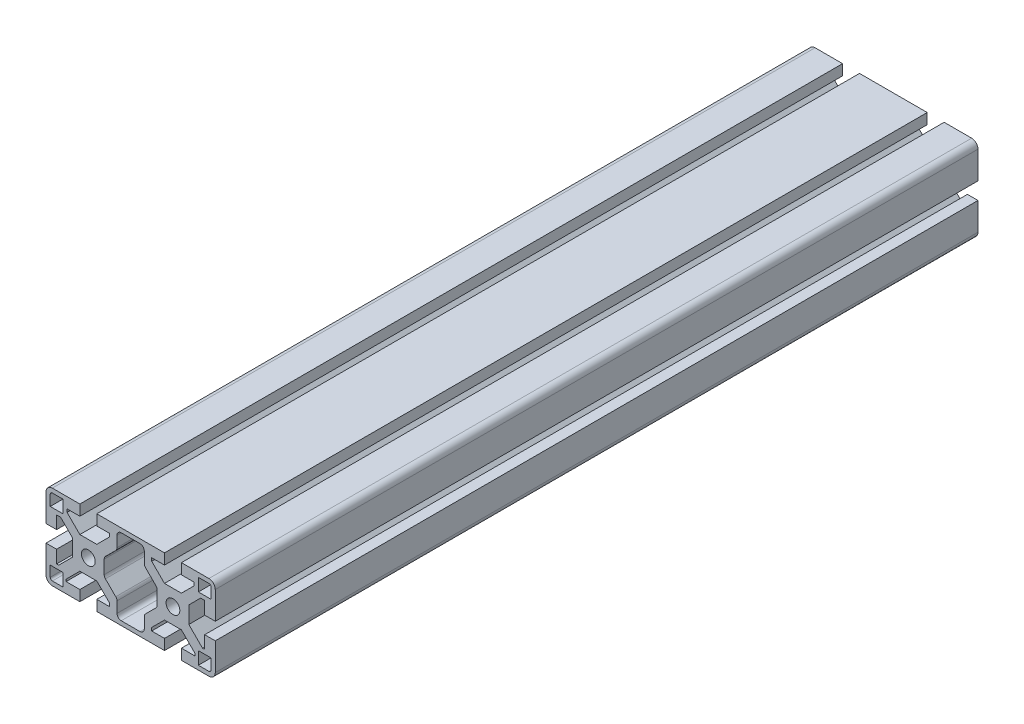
SolidWorks part; units mm, degrees
ref_plane "Alzado" through (0, 0, 0) normal (0, 0, 1) x (1, 0, 0)
ref_plane "Planta" through (0, 0, 0) normal (0, 1, 0) x (1, 0, 0)
ref_plane "Vista lateral" through (0, 0, 0) normal (1, 0, 0) x (0, 0, -1)
sketch "Croquis1" plane through (0, 0, 0) normal (0, 0, 1) x (1, 0, 0)
  line L0 (-18, 12) -> (-12, 12)
  line L1 (-12, 12) -> (-12, 18)
  line L2 (-17, 18) -> (-12, 18)
  line L3 (-18, 12) -> (-18, 17)
  line L4 (24.45, 18) -> (15.55, 18)
  line L5 (31.9142, 4.5858) -> (27.0358, 9.4642)
  line L6 (31.9142, -4.5858) -> (27.0358, -9.4642)
  line L7 (50.0629, 13.55) -> (50.0629, 15)
  line L8 (-17, -18) -> (-12, -18)
  line L9 (-12, -18) -> (-12, -12)
  line L10 (-18, -12) -> (-12, -12)
  line L11 (-18, -17) -> (-18, -12)
  line L12 (50.0629, 13.55) -> (44, 7.5)
  line L13 (50.0629, 15) -> (44, 15)
  line L14 (29.95, 13.55) -> (29.95, 15)
  line L15 (36, 7.5) -> (29.95, 13.55)
  line L16 (-4, 7.5) -> (4, 7.5)
  line L17 (-17, 20) -> (-4, 20)
  line L18 (-7.5, -3.55) -> (-7.5, 4.45)
  line L19 (-4, -7.5) -> (4, -7.5)
  line L20 (7.5, -3.1716) -> (7.5, 3.1716)
  line L21 (36, 15) -> (29.95, 15)
  line L22 (4, 20) -> (4, 15)
  line L23 (55, 10.05) -> (53.1, 10.05)
  line L24 (4, 20) -> (36, 20)
  line L25 (-17, -20) -> (-4, -20)
  line L26 (-4, -20) -> (-4, -15)
  line L27 (36, -20) -> (4, -20)
  line L28 (-15, -10.05) -> (-15, -4)
  line L29 (-20, 4) -> (-20, 17)
  line L30 (-20, -17) -> (-20, -4)
  line L31 (-20, -4) -> (-15, -4)
  line L32 (4, -20) -> (4, -15)
  line L33 (-4, 20) -> (-4, 15)
  line L34 (47.5, 4.45) -> (53.1, 10.05)
  line L35 (55, 4) -> (55, 10.05)
  line L36 (60, 4) -> (55, 4)
  line L37 (4, -15) -> (10.05, -15)
  line L38 (-10.5, -15) -> (-4, -15)
  line L39 (-10.5, -14) -> (-4, -7.5)
  line L40 (-10.5, -14) -> (-10.5, -15)
  line L41 (4, -7.5) -> (10.05, -13.55)
  line L42 (10.05, -15) -> (10.05, -13.55)
  line L43 (-7.5, -3.55) -> (-14, -10.05)
  line L44 (-15, -10.05) -> (-14, -10.05)
  line L45 (-20, 4) -> (-15, 4)
  line L46 (-15, 4) -> (-15, 10.05)
  line L47 (-7.5, 4.45) -> (-13.1, 10.05)
  line L48 (-15, 10.05) -> (-13.1, 10.05)
  line L49 (4, 15) -> (10.05, 15)
  line L50 (4, 7.5) -> (10.05, 13.55)
  line L51 (10.05, 13.55) -> (10.05, 15)
  line L52 (-10.0629, 15) -> (-4, 15)
  line L53 (-10.0629, 13.55) -> (-4, 7.5)
  line L54 (-10.0629, 13.55) -> (-10.0629, 15)
  line L55 (55, -10.05) -> (54, -10.05)
  line L56 (47.5, -3.55) -> (54, -10.05)
  line L57 (8.0858, -4.5858) -> (12.9642, -9.4642)
  line L58 (29.95, -15) -> (29.95, -13.55)
  line L59 (8.0858, 4.5858) -> (12.9642, 9.4642)
  line L60 (36, -7.5) -> (29.95, -13.55)
  line L61 (50.5, -14) -> (50.5, -15)
  line L62 (50.5, -14) -> (44, -7.5)
  line L63 (50.5, -15) -> (44, -15)
  line L64 (36, -15) -> (29.95, -15)
  line L65 (44, 20) -> (44, 15)
  line L66 (36, -20) -> (36, -15)
  line L67 (60, -4) -> (55, -4)
  line L68 (60, -17) -> (60, -4)
  line L69 (60, 4) -> (60, 17)
  line L70 (55, -10.05) -> (55, -4)
  line L71 (44, -20) -> (44, -15)
  line L72 (57, -20) -> (44, -20)
  line L73 (36, 20) -> (36, 15)
  line L74 (32.5, -3.1716) -> (32.5, 3.1716)
  line L75 (44, -7.5) -> (36, -7.5)
  line L76 (47.5, -3.55) -> (47.5, 4.45)
  line L77 (57, 20) -> (44, 20)
  line L78 (44, 7.5) -> (36, 7.5)
  line L79 (58, -17) -> (58, -12)
  line L80 (58, -12) -> (52, -12)
  line L81 (52, -18) -> (52, -12)
  line L82 (57, -18) -> (52, -18)
  line L83 (58, 12) -> (58, 17)
  line L84 (57, 18) -> (52, 18)
  line L85 (52, 12) -> (52, 18)
  line L86 (58, 12) -> (52, 12)
  line L87 (13.55, 10.8784) -> (13.55, 16)
  line L88 (26.45, 10.8784) -> (26.45, 16)
  line L89 (24.45, -18) -> (15.55, -18)
  line L90 (13.55, -10.8784) -> (13.55, -16)
  line L91 (26.45, -10.8784) -> (26.45, -16)
  arc A0 (-18, 17) -> (-17, 18) centre (-17, 17) cw
  arc A1 (57, -20) -> (60, -17) centre (57, -17) ccw
  arc A2 (-18, -17) -> (-17, -18) centre (-17, -17) ccw
  arc A3 (60, 17) -> (57, 20) centre (57, 17) ccw
  circle A4 centre (0, 0) radius 3.25
  circle A5 centre (40, 0) radius 3.25
  arc A6 (-20, 17) -> (-17, 20) centre (-17, 17) cw
  arc A7 (-17, -20) -> (-20, -17) centre (-17, -17) cw
  arc A8 (58, -17) -> (57, -18) centre (57, -17) cw
  arc A9 (58, 17) -> (57, 18) centre (57, 17) ccw
  arc A10 (13.55, 16) -> (15.55, 18) centre (15.55, 16) cw
  arc A11 (12.9642, 9.4642) -> (13.55, 10.8784) centre (11.55, 10.8784) ccw
  arc A12 (7.5, 3.1716) -> (8.0858, 4.5858) centre (9.5, 3.1716) cw
  arc A13 (8.0858, -4.5858) -> (7.5, -3.1716) centre (9.5, -3.1716) cw
  arc A14 (13.55, -10.8784) -> (12.9642, -9.4642) centre (11.55, -10.8784) ccw
  arc A15 (15.55, -18) -> (13.55, -16) centre (15.55, -16) cw
  arc A16 (26.45, -16) -> (24.45, -18) centre (24.45, -16) cw
  arc A17 (32.5, -3.1716) -> (31.9142, -4.5858) centre (30.5, -3.1716) cw
  arc A18 (26.45, -10.8784) -> (27.0358, -9.4642) centre (28.45, -10.8784) cw
  arc A19 (26.45, 16) -> (24.45, 18) centre (24.45, 16) ccw
  arc A20 (26.45, 10.8784) -> (27.0358, 9.4642) centre (28.45, 10.8784) ccw
  arc A21 (32.5, 3.1716) -> (31.9142, 4.5858) centre (30.5, 3.1716) ccw
  point P115 (13.55, 10.05)
  point P118 (7.5, 4)
  point P121 (7.5, -4)
  point P124 (13.55, -10.05)
extrude "Extruir5" add sketch "Croquis1" along normal blind 360.5
